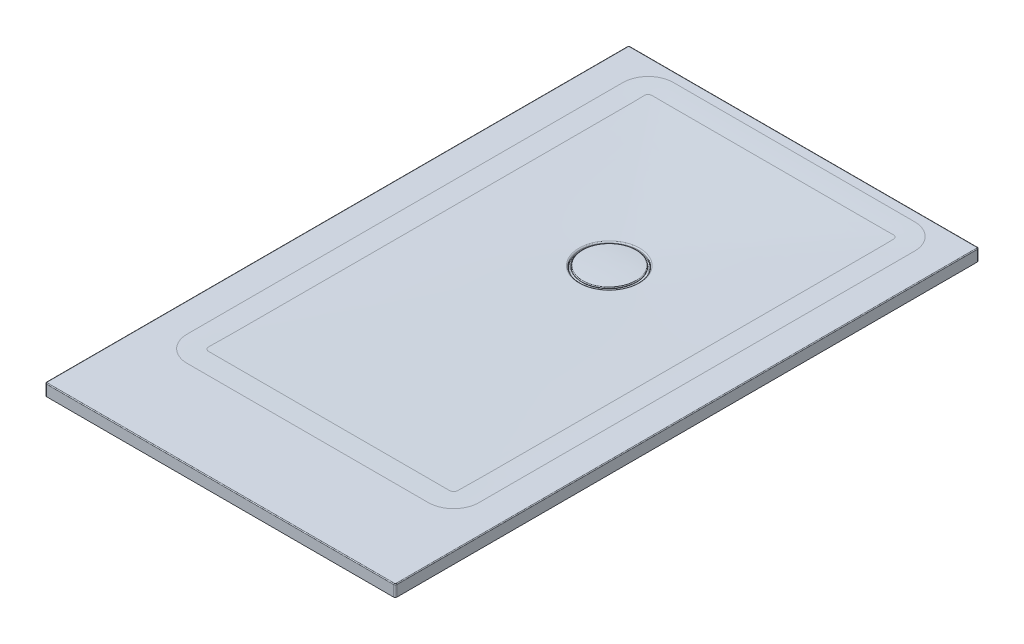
SolidWorks part; units mm, degrees
ref_plane "Płaszczyzna przednia" through (0, 0, 0) normal (0, 0, 1) x (1, 0, 0)
ref_plane "Płaszczyzna górna" through (0, 0, 0) normal (0, 1, 0) x (1, 0, 0)
ref_plane "Płaszczyzna prawa" through (0, 0, 0) normal (1, 0, 0) x (0, 0, -1)
sketch "Szkic2" plane through (0, 0, 0) normal (0, 1, 0) x (1, 0, 0)
  line L0 (0, 750) -> (0, 250) construction
  line L1 (-450, -750) -> (450, -750)
  line L2 (-450, -750) -> (-450, 750)
  line L3 (-450, 750) -> (450, 750)
  line L4 (450, -750) -> (450, 750)
  line L5 (-450, -750) -> (450, 750) construction
  line L6 (-450, 750) -> (450, -750) construction
  line L7 (-360, 710) -> (360, 710)
  line L8 (-360, 710) -> (-360, -510)
  line L9 (-360, -510) -> (360, -510)
  line L10 (360, 710) -> (360, -510)
  line L11 (-400, 750) -> (-400, -550) construction
  line L12 (-400, -550) -> (400, -550) construction
  line L13 (400, -550) -> (400, 750) construction
  circle A0 centre (0, 250) radius 75
  point P0 (0, 0)
  point P11 (0, 710)
  point P16 (0, -550)
  dimension "D9" = 150
  dimension "D1" = 900
  dimension "D2" = 1500
  dimension "D3" = 40
  dimension "D4" = 90
  dimension "D5" = 40
  dimension "D6" = 50
  dimension "D7" = 1300
  dimension "D8" = 500
  dimension "D10" = 800
sketch "Szkic3" plane through (0, 0, 0) normal (0, 1, 0) x (1, 0, 0)
  line L0 (-450, -750) -> (-450, 750) construction
  line L1 (-450, -750) -> (450, -750) construction
  line L2 (450, -750) -> (450, 750) construction
  line L3 (-450, 750) -> (450, 750) construction
  line L4 (-360, 710) -> (-360, -510) construction
  line L5 (-360, 710) -> (360, 710) construction
  line L6 (360, 710) -> (360, -510) construction
  line L7 (-360, -510) -> (360, -510) construction
  line L8 (-450, -750) -> (-450, 750)
  line L9 (-450, -750) -> (450, -750)
  line L10 (450, -750) -> (450, 750)
  line L11 (-450, 750) -> (450, 750)
  line L12 (-360, 660) -> (-360, -460)
  line L13 (-310, 710) -> (310, 710)
  line L14 (360, 660) -> (360, -460)
  line L15 (-310, -510) -> (310, -510)
  arc A0 (360, 660) -> (310, 710) centre (310, 660) ccw
  arc A1 (-310, 710) -> (-360, 660) centre (-310, 660) ccw
  arc A2 (310, -510) -> (360, -460) centre (310, -460) ccw
  arc A3 (-310, -510) -> (-360, -460) centre (-310, -460) cw
  dimension "D1" = 50
surface "Powierzchnia-Płaszczyzna1" sketch "Szkic3"
sketch "Szkic4" plane through (0, 0, 0) normal (0, 1, 0) x (1, 0, 0)
  line L0 (-360, 710) -> (-360, -510) construction
  line L1 (-360, -510) -> (360, -510) construction
  line L2 (360, 710) -> (360, -510) construction
  line L3 (-360, 710) -> (360, 710) construction
  line L4 (-360, 710) -> (-360, -510)
  line L5 (-360, -510) -> (360, -510)
  line L6 (360, 710) -> (360, -510)
  line L7 (-360, 710) -> (360, 710)
ref_plane "korek" through (0, -15, 0) normal (0, 1, 0) x (-1, 0, 0)
sketch "Szkic5" plane through (0, -15, 0) normal (0, 1, 0) x (-1, 0, 0)
  circle A0 centre (0, -250) radius 75 construction
  circle A1 centre (0, -250) radius 75
surface "Powierzchnia-Wyciągnięcie po profilach2"
surface "Powierzchnia-Połącz1"
sketch "Szkic7" plane through (0, 0, 0) normal (0, 1, 0) x (1, 0, 0)
  line L27 (310, 670) -> (-310, 670)
  line L28 (-320, 660) -> (-320, -460)
  line L29 (-310, -470) -> (310, -470)
  line L30 (320, -460) -> (320, 660)
  line L31 (310, 670) -> (-310, 670)
  line L32 (-320, 660) -> (-320, -460)
  line L33 (-310, -470) -> (310, -470)
  line L34 (320, -460) -> (320, 660)
  line L35 (310, 725) -> (-310, 725)
  line L36 (-375, 660) -> (-375, -460)
  line L37 (-310, -525) -> (310, -525)
  line L38 (375, -460) -> (375, 660)
  line L39 (310, 725) -> (-310, 725)
  line L40 (-375, 660) -> (-375, -460)
  line L41 (-310, -525) -> (310, -525)
  line L42 (375, -460) -> (375, 660)
  arc A0 (320, -460) -> (310, -470) centre (310, -460) cw
  arc A1 (-320, -460) -> (-310, -470) centre (-310, -460) ccw
  arc A2 (320, 660) -> (310, 670) centre (310, 660) ccw
  arc A3 (-320, 660) -> (-310, 670) centre (-310, 660) cw
  spline S23 degree 3 poles (-642.8943, 390.1256) (149.3888, 561.0059) (326.7189, 627.1644) (319.7449, 662.2674) (319.666, 662.5841) (319.4757, 663.2119) (319.3643, 663.524) (318.9882, 664.4318) (318.6815, 665.006) (318.1378, 665.8209) (317.9419, 666.0856) (317.5241, 666.5952) (317.3042, 666.8377) (316.613, 667.5296) (316.11, 667.9435) (315.291, 668.492) (315.0072, 668.6623) (314.4304, 668.971) (314.1358, 669.1105) (313.5347, 669.3602) (313.228, 669.4702) (312.6027, 669.6611) (312.2823, 669.7412) (233.9028, 685.5116) (48.4869, -263.7118) (182.9274, 1661.8833) knots -6.683225 -6.683225 -6.683225 -6.683225 0.125 0.125 0.1875 0.1875 0.25 0.25 0.375 0.375 0.4375 0.4375 0.5 0.5 0.625 0.625 0.6875 0.6875 0.75 0.75 0.8125 0.8125 0.875 0.875 15.981954 15.981954 15.981954 15.981954 only from (320, 660) to (310, 670)
  spline S24 degree 3 poles (-9.0175, -283.6291) (-166.6137, 366.6076) (-266.6453, 678.8698) (-312.2675, 669.7445) (-312.5843, 669.6661) (-313.2122, 669.4757) (-313.5243, 669.3642) (-314.4321, 668.988) (-315.0062, 668.6813) (-316.0928, 667.9564) (-316.6074, 667.5345) (-317.5297, 666.6127) (-317.9436, 666.1098) (-318.4921, 665.2909) (-318.6623, 665.0071) (-318.9712, 664.4303) (-319.1105, 664.1357) (-319.3602, 663.5346) (-319.4703, 663.2279) (-319.661, 662.6026) (-319.7416, 662.2823) (-328.2879, 619.511) (-59.3278, 546.1832) (651.664, 423.6572) knots -8.743386 -8.743386 -8.743386 -8.743386 0.125 0.125 0.1875 0.1875 0.25 0.25 0.375 0.375 0.5 0.5 0.625 0.625 0.6875 0.6875 0.75 0.75 0.8125 0.8125 0.875 0.875 9.089451 9.089451 9.089451 9.089451 only from (-310, 670) to (-320, 660)
  spline S25 degree 3 poles (642.8944, -190.1256) (-149.3888, -361.0059) (-326.7189, -427.1644) (-319.7449, -462.2674) (-319.666, -462.5841) (-319.4757, -463.2119) (-319.3643, -463.524) (-318.9882, -464.4318) (-318.6815, -465.006) (-318.1378, -465.8209) (-317.9419, -466.0856) (-317.5241, -466.5952) (-317.3042, -466.8377) (-316.613, -467.5296) (-316.11, -467.9435) (-315.291, -468.492) (-315.0072, -468.6623) (-314.4304, -468.971) (-314.1358, -469.1105) (-313.5347, -469.3602) (-313.228, -469.4702) (-312.6027, -469.6611) (-312.2823, -469.7412) (-233.9028, -485.5116) (-48.4869, 463.7118) (-182.9274, -1461.8831) knots -6.683225 -6.683225 -6.683225 -6.683225 0.125 0.125 0.1875 0.1875 0.25 0.25 0.375 0.375 0.4375 0.4375 0.5 0.5 0.625 0.625 0.6875 0.6875 0.75 0.75 0.8125 0.8125 0.875 0.875 15.981954 15.981954 15.981954 15.981954 only from (-320, -460) to (-310, -470)
  spline S26 degree 3 poles (9.0175, 483.6287) (166.6137, -166.6076) (266.6453, -478.8698) (312.2675, -469.7445) (312.5843, -469.6661) (313.2122, -469.4757) (313.5243, -469.3642) (314.4321, -468.988) (315.0062, -468.6813) (316.0928, -467.9564) (316.6074, -467.5345) (317.5297, -466.6127) (317.9436, -466.1098) (318.4921, -465.2909) (318.6623, -465.0071) (318.9712, -464.4303) (319.1105, -464.1357) (319.3602, -463.5346) (319.4703, -463.2279) (319.661, -462.6026) (319.7416, -462.2823) (328.2879, -419.511) (59.3278, -346.1832) (-651.664, -223.6572) knots -8.743386 -8.743386 -8.743386 -8.743386 0.125 0.125 0.1875 0.1875 0.25 0.25 0.375 0.375 0.5 0.5 0.625 0.625 0.6875 0.6875 0.75 0.75 0.8125 0.8125 0.875 0.875 9.089451 9.089451 9.089451 9.089451 only from (310, -470) to (320, -460)
  spline S31 degree 3 poles (-2447.7047, -314.0362) (-185.2907, 240.0079) (406.1711, 509.4635) (373.3422, 674.7387) (372.8284, 676.7971) (371.9015, 679.858) (371.5659, 680.8756) (370.8441, 682.8941) (370.4598, 683.8904) (368.4228, 688.8079) (366.4286, 692.5398) (363.4838, 696.9542) (362.872, 697.8244) (361.6022, 699.5392) (360.9423, 700.3859) (358.9054, 702.8701) (357.4764, 704.4463) (352.9829, 708.9432) (349.7138, 711.6339) (345.2776, 714.6043) (344.3701, 715.1801) (342.5356, 716.2812) (341.6082, 716.8072) (338.7961, 718.3122) (336.8815, 719.2187) (332.9742, 720.8414) (330.9813, 721.5572) (327.9325, 722.4866) (326.9063, 722.772) (324.8335, 723.2937) (323.7851, 723.5302) (320.6362, 724.1601) (318.5251, 724.4736) (163.2625, 739.8239) (-49.5542, 217.9201) (-468.4264, -2158.323) knots -4.789116 -4.789116 -4.789116 -4.789116 0.125 0.125 0.1875 0.1875 0.21875 0.21875 0.25 0.25 0.375 0.375 0.40625 0.40625 0.4375 0.4375 0.5 0.5 0.625 0.625 0.65625 0.65625 0.6875 0.6875 0.75 0.75 0.8125 0.8125 0.84375 0.84375 0.875 0.875 0.9375 0.9375 5.446732 5.446732 5.446732 5.446732 only from (375, 660) to (310, 725)
  spline S32 degree 3 poles (596.581, -2122.2579) (40.5769, 304.1735) (-176.0767, 738.5172) (-318.4945, 724.4772) (-320.5876, 724.1673) (-324.7388, 723.3419) (-326.7973, 722.8285) (-329.8582, 721.9015) (-330.8757, 721.5658) (-332.8944, 720.8441) (-333.8906, 720.4597) (-338.8082, 718.4227) (-342.5401, 716.4285) (-346.9544, 713.4837) (-347.8246, 712.8719) (-349.5394, 711.6021) (-350.3861, 710.9423) (-352.8702, 708.9053) (-354.4465, 707.4763) (-358.9432, 702.9827) (-361.6339, 699.7136) (-364.6044, 695.2776) (-365.1801, 694.3701) (-366.2812, 692.5355) (-366.8072, 691.6081) (-368.3123, 688.796) (-369.2188, 686.8814) (-370.8414, 682.9741) (-371.5573, 680.9812) (-372.4865, 677.9324) (-372.772, 676.9062) (-373.2938, 674.8335) (-373.5304, 673.7851) (-412.3675, 479.409) (435.0195, 187.6621) (2471.4757, -236.1691) knots -4.092623 -4.092623 -4.092623 -4.092623 0.0625 0.0625 0.125 0.125 0.1875 0.1875 0.21875 0.21875 0.25 0.25 0.375 0.375 0.40625 0.40625 0.4375 0.4375 0.5 0.5 0.625 0.625 0.65625 0.65625 0.6875 0.6875 0.75 0.75 0.8125 0.8125 0.84375 0.84375 0.875 0.875 6.630659 6.630659 6.630659 6.630659 only from (-310, 725) to (-375, 660)
  spline S33 degree 3 poles (2447.7047, 514.0362) (185.2907, -40.0079) (-406.1711, -309.4635) (-373.3422, -474.7387) (-372.8284, -476.7971) (-371.9015, -479.858) (-371.5659, -480.8756) (-370.8441, -482.8941) (-370.4598, -483.8904) (-368.4228, -488.8079) (-366.4286, -492.5398) (-363.4838, -496.9542) (-362.872, -497.8244) (-361.6022, -499.5392) (-360.9423, -500.3859) (-358.9054, -502.8701) (-357.4764, -504.4463) (-352.9829, -508.9432) (-349.7138, -511.6339) (-345.2776, -514.6043) (-344.3701, -515.1801) (-342.5356, -516.2812) (-341.6082, -516.8072) (-338.7961, -518.3122) (-336.8815, -519.2187) (-332.9742, -520.8414) (-330.9813, -521.5572) (-327.9325, -522.4866) (-326.9063, -522.772) (-324.8335, -523.2937) (-323.7851, -523.5302) (-320.6362, -524.1601) (-318.5251, -524.4736) (-163.2625, -539.8239) (49.5542, -17.9201) (468.4264, 2358.3231) knots -4.789116 -4.789116 -4.789116 -4.789116 0.125 0.125 0.1875 0.1875 0.21875 0.21875 0.25 0.25 0.375 0.375 0.40625 0.40625 0.4375 0.4375 0.5 0.5 0.625 0.625 0.65625 0.65625 0.6875 0.6875 0.75 0.75 0.8125 0.8125 0.84375 0.84375 0.875 0.875 0.9375 0.9375 5.446732 5.446732 5.446732 5.446732 only from (-375, -460) to (-310, -525)
  spline S34 degree 3 poles (-596.581, 2322.2578) (-40.5769, -104.1735) (176.0767, -538.5172) (318.4945, -524.4772) (320.5876, -524.1673) (324.7388, -523.3419) (326.7973, -522.8285) (329.8582, -521.9015) (330.8757, -521.5658) (332.8944, -520.8441) (333.8906, -520.4597) (338.8082, -518.4227) (342.5401, -516.4285) (346.9544, -513.4837) (347.8246, -512.8719) (349.5394, -511.6021) (350.3861, -510.9423) (352.8702, -508.9053) (354.4465, -507.4763) (358.9432, -502.9827) (361.6339, -499.7136) (364.6044, -495.2776) (365.1801, -494.3701) (366.2812, -492.5355) (366.8072, -491.6081) (368.3123, -488.796) (369.2188, -486.8814) (370.8414, -482.9741) (371.5573, -480.9812) (372.4865, -477.9324) (372.772, -476.9062) (373.2938, -474.8335) (373.5304, -473.7851) (412.3675, -279.409) (-435.0195, 12.3379) (-2471.4757, 436.1691) knots -4.092623 -4.092623 -4.092623 -4.092623 0.0625 0.0625 0.125 0.125 0.1875 0.1875 0.21875 0.21875 0.25 0.25 0.375 0.375 0.40625 0.40625 0.4375 0.4375 0.5 0.5 0.625 0.625 0.65625 0.65625 0.6875 0.6875 0.75 0.75 0.8125 0.8125 0.84375 0.84375 0.875 0.875 6.630659 6.630659 6.630659 6.630659 only from (310, -525) to (375, -460)
  spline S35 degree 3 poles (375, 660) (375, 664.2917) (374.5791, 668.5118) (373.3422, 674.7387) (372.8284, 676.7971) (371.9015, 679.858) (371.5659, 680.8756) (370.8441, 682.8941) (370.4598, 683.8904) (368.4228, 688.8079) (366.4286, 692.5398) (363.4838, 696.9542) (362.872, 697.8244) (361.6022, 699.5392) (360.9423, 700.3859) (358.9054, 702.8701) (357.4764, 704.4463) (352.9829, 708.9432) (349.7138, 711.6339) (345.2776, 714.6043) (344.3701, 715.1801) (342.5356, 716.2812) (341.6082, 716.8072) (338.7961, 718.3122) (336.8815, 719.2187) (332.9742, 720.8414) (330.9813, 721.5572) (327.9325, 722.4866) (326.9063, 722.772) (324.8335, 723.2937) (323.7851, 723.5302) (320.6362, 724.1601) (318.5251, 724.4736) (314.28, 724.8933) (312.1459, 725) (310, 725) knots 0 0 0 0 0.125 0.125 0.1875 0.1875 0.21875 0.21875 0.25 0.25 0.375 0.375 0.40625 0.40625 0.4375 0.4375 0.5 0.5 0.625 0.625 0.65625 0.65625 0.6875 0.6875 0.75 0.75 0.8125 0.8125 0.84375 0.84375 0.875 0.875 0.9375 0.9375 1 1 1 1
  spline S36 degree 3 poles (-310, 725) (-312.1459, 725) (-314.2736, 724.8933) (-318.4945, 724.4772) (-320.5876, 724.1673) (-324.7388, 723.3419) (-326.7973, 722.8285) (-329.8582, 721.9015) (-330.8757, 721.5658) (-332.8944, 720.8441) (-333.8906, 720.4597) (-338.8082, 718.4227) (-342.5401, 716.4285) (-346.9544, 713.4837) (-347.8246, 712.8719) (-349.5394, 711.6021) (-350.3861, 710.9423) (-352.8702, 708.9053) (-354.4465, 707.4763) (-358.9432, 702.9827) (-361.6339, 699.7136) (-364.6044, 695.2776) (-365.1801, 694.3701) (-366.2812, 692.5355) (-366.8072, 691.6081) (-368.3123, 688.796) (-369.2188, 686.8814) (-370.8414, 682.9741) (-371.5573, 680.9812) (-372.4865, 677.9324) (-372.772, 676.9062) (-373.2938, 674.8335) (-373.5304, 673.7851) (-374.579, 668.5368) (-375, 664.2918) (-375, 660) knots 0 0 0 0 0.0625 0.0625 0.125 0.125 0.1875 0.1875 0.21875 0.21875 0.25 0.25 0.375 0.375 0.40625 0.40625 0.4375 0.4375 0.5 0.5 0.625 0.625 0.65625 0.65625 0.6875 0.6875 0.75 0.75 0.8125 0.8125 0.84375 0.84375 0.875 0.875 1 1 1 1
  spline S37 degree 3 poles (-375, -460) (-375, -464.2917) (-374.5791, -468.5118) (-373.3422, -474.7387) (-372.8284, -476.7971) (-371.9015, -479.858) (-371.5659, -480.8756) (-370.8441, -482.8941) (-370.4598, -483.8904) (-368.4228, -488.8079) (-366.4286, -492.5398) (-363.4838, -496.9542) (-362.872, -497.8244) (-361.6022, -499.5392) (-360.9423, -500.3859) (-358.9054, -502.8701) (-357.4764, -504.4463) (-352.9829, -508.9432) (-349.7138, -511.6339) (-345.2776, -514.6043) (-344.3701, -515.1801) (-342.5356, -516.2812) (-341.6082, -516.8072) (-338.7961, -518.3122) (-336.8815, -519.2187) (-332.9742, -520.8414) (-330.9813, -521.5572) (-327.9325, -522.4866) (-326.9063, -522.772) (-324.8335, -523.2937) (-323.7851, -523.5302) (-320.6362, -524.1601) (-318.5251, -524.4736) (-314.28, -524.8933) (-312.1459, -525) (-310, -525) knots 0 0 0 0 0.125 0.125 0.1875 0.1875 0.21875 0.21875 0.25 0.25 0.375 0.375 0.40625 0.40625 0.4375 0.4375 0.5 0.5 0.625 0.625 0.65625 0.65625 0.6875 0.6875 0.75 0.75 0.8125 0.8125 0.84375 0.84375 0.875 0.875 0.9375 0.9375 1 1 1 1
  spline S38 degree 3 poles (310, -525) (312.1459, -525) (314.2736, -524.8933) (318.4945, -524.4772) (320.5876, -524.1673) (324.7388, -523.3419) (326.7973, -522.8285) (329.8582, -521.9015) (330.8757, -521.5658) (332.8944, -520.8441) (333.8906, -520.4597) (338.8082, -518.4227) (342.5401, -516.4285) (346.9544, -513.4837) (347.8246, -512.8719) (349.5394, -511.6021) (350.3861, -510.9423) (352.8702, -508.9053) (354.4465, -507.4763) (358.9432, -502.9827) (361.6339, -499.7136) (364.6044, -495.2776) (365.1801, -494.3701) (366.2812, -492.5355) (366.8072, -491.6081) (368.3123, -488.796) (369.2188, -486.8814) (370.8414, -482.9741) (371.5573, -480.9812) (372.4865, -477.9324) (372.772, -476.9062) (373.2938, -474.8335) (373.5304, -473.7851) (374.579, -468.5368) (375, -464.2918) (375, -460) knots 0 0 0 0 0.0625 0.0625 0.125 0.125 0.1875 0.1875 0.21875 0.21875 0.25 0.25 0.375 0.375 0.40625 0.40625 0.4375 0.4375 0.5 0.5 0.625 0.625 0.65625 0.65625 0.6875 0.6875 0.75 0.75 0.8125 0.8125 0.84375 0.84375 0.875 0.875 1 1 1 1
  dimension "D3" = 10
  dimension "D1" = 40
  dimension "D2" = 15
other "Usuń ścianę1"
other "Granica-Powierzchnia1"
surface "Powierzchnia-Połącz2"
sketch "Szkic9" plane through (0, 0, 0) normal (0, 1, 0) x (1, 0, 0)
  line L0 (-450, -750) -> (450, -750) construction
  line L1 (-450, -750) -> (-450, 750) construction
  line L2 (450, -750) -> (450, 750) construction
  line L3 (-450, 750) -> (450, 750) construction
  line L4 (-450, -750) -> (450, -750)
  line L5 (-450, -750) -> (-450, 750)
  line L6 (450, -750) -> (450, 750)
  line L7 (-450, 750) -> (450, 750)
surface "Powierzchnia-Wyciągnięcie1" sketch "Szkic9" parameters "D1"=30
sketch "Szkic8" plane through (0, 0, 0) normal (1, 0, 0) x (0, 0, -1)
  line L0 (250, 0) -> (250, -30) construction
  line L1 (175, -15) -> (175.2968, -23.5)
  line L4 (175.2968, -23.5) -> (198, -24.0945)
  line L5 (175.2968, -23.5) -> (250, -23.5) construction
  line L6 (198, -24.0945) -> (198, -30) construction
  line L7 (250, -30) -> (175.2968, -30) construction
  line L8 (175.2968, -30) -> (175.2968, -23.5) construction
  line L9 (205, -28) -> (205, -30)
  line L10 (198, -24.0945) -> (205, -28)
  dimension "D1" = 30
  dimension "D2" = 8.5
  dimension "D3" = 2
  dimension "D4" = 1.5
  dimension "D5" = 52
  dimension "D6" = 45
  dimension "D7" = 2
surface "Powierzchnia-Obrót1" sketch "Szkic8" parameters "D1"=360
surface "Powierzchnia-Płaszczyzna2"
surface "Powierzchnia-Połącz3"
fillet "Zaokrąglenie4" radius 4 4 edges at (-450, -15, -750) (450, -15, -750) (-450, -15, 750) (450, -15, 750)
fillet "Zaokrąglenie5" radius 3 3 edges at (0, -24.0945, -302) (0, -23.5, -324.7032)
fillet "Zaokrąglenie6" radius 2 9 edges at (448.8284, 0, 748.8284) (0, 0, 750) (-448.8284, 0, 748.8284) (-450, 0, 0) (-448.8284, 0, -748.8284) (0, 0, -750) (448.8284, 0, -748.8284) (450, 0, 0) (0, -28, -295)
sketch "Szkic11" plane through (0, 0, 0) normal (1, 0, 0) x (0, 0, -1)
  line L0 (250, 0) -> (250, -30) construction
  line L1 (-746, -30) -> (746, -30) construction
  line L2 (250, -17) -> (250, -11.5)
  line L14 (320, -11.5) -> (320, -14.5) construction
  line L16 (320, -17) -> (250, -17)
  line L18 (320, -17) -> (320, -16.3377)
  line L19 (250, -11.5) -> (320, -11.5) construction
  arc A0 (320, -16.3377) -> (318.1666, -14.3446) centre (318, -16.3377) ccw
  arc A6 (318.1666, -14.3446) -> (250, -11.5) centre (250, -829.6667) ccw
  dimension "D2" = 2
  dimension "D8" = 2.5
  dimension "D9" = 17
  dimension "D10" = 5.5
  dimension "D11" = 70
revolve "Obrót1" add sketch "Szkic11" angle 360 about L0
